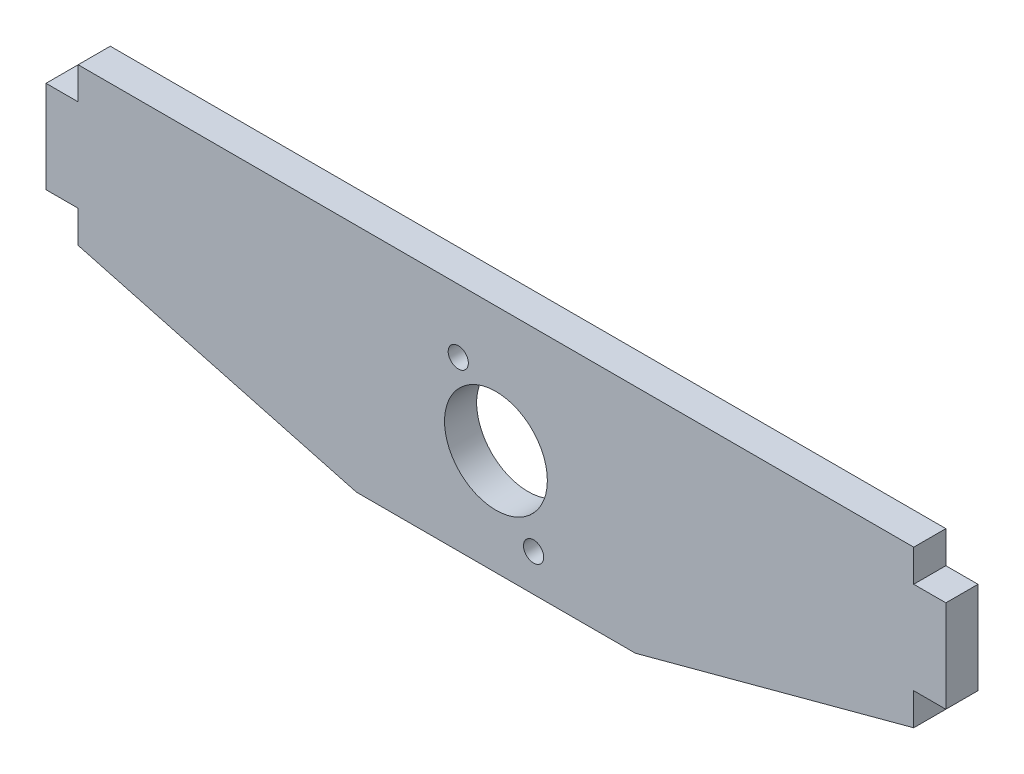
SolidWorks part; units mm, degrees
ref_plane "Front Plane" through (0, 0, 0) normal (0, 0, 1) x (1, 0, 0)
ref_plane "Top Plane" through (0, 0, 0) normal (0, 1, 0) x (1, 0, 0)
ref_plane "Right Plane" through (0, 0, 0) normal (1, 0, 0) x (0, 0, -1)
sketch "Sketch1" plane through (0, 0, 0) normal (0, 0, 1) x (1, 0, 0)
  line L1 (-44.45, 12.7) -> (44.45, 12.7)
  line L2 (-44.45, 12.7) -> (-44.45, -12.7)
  line L3 (-44.45, -12.7) -> (44.45, -12.7)
  line L4 (44.45, 12.7) -> (44.45, -12.7)
  line L5 (-44.45, 12.7) -> (44.45, -12.7) construction
  line L6 (-44.45, -12.7) -> (44.45, 12.7) construction
  point P0 (0, 0)
  dimension "D1" = 25.4
  dimension "D2" = 88.9
extrude "Boss-Extrude1" add sketch "Sketch1" along normal mid plane 3.175
sketch "Sketch2" plane through (0, 0, 1.5875) normal (0, 0, 1) x (1, 0, 0)
  line L0 (0, 21.37) -> (0, -23.2469) construction
  line L1 (-44.45, 12.7) -> (-41.275, 12.7)
  line L2 (-44.45, 12.7) -> (-44.45, 9.525)
  line L3 (-44.45, 9.525) -> (-41.275, 9.525)
  line L4 (-41.275, 12.7) -> (-41.275, 9.525)
  line L5 (-48.7544, 0) -> (49.9487, 0) construction
  line L6 (41.275, 12.7) -> (41.275, 9.525)
  line L7 (44.45, 9.525) -> (41.275, 9.525)
  line L8 (44.45, 12.7) -> (44.45, 9.525)
  line L9 (44.45, 12.7) -> (41.275, 12.7)
  line L10 (44.45, -12.7) -> (41.275, -12.7)
  line L11 (44.45, -12.7) -> (44.45, -9.525)
  line L12 (44.45, -9.525) -> (41.275, -9.525)
  line L13 (41.275, -12.7) -> (41.275, -9.525)
  line L14 (-41.275, -12.7) -> (-41.275, -9.525)
  line L15 (-44.45, -9.525) -> (-41.275, -9.525)
  line L16 (-44.45, -12.7) -> (-44.45, -9.525)
  line L17 (-44.45, -12.7) -> (-41.275, -12.7)
  dimension "D1" = 3.175
  dimension "D2" = 3.175
extrude "Cut-Extrude1" cut sketch "Sketch2" against normal through all
sketch "Sketch3" plane through (0, 0, 1.5875) normal (0, 0, 1) x (1, 0, 0)
  line L0 (-44.45, 9.525) -> (-44.45, -9.525) construction
  line L2 (41.275, 12.7) -> (-41.275, 12.7) construction
  circle A0 centre (0, 0.3048) radius 5.08
  dimension "D1" = 10.16
  dimension "D2" = 44.45
  dimension "D3" = 12.3952
extrude "Cut-Extrude2" cut sketch "Sketch3" against normal through all
hole_wizard "#47 (0.0785) Diameter Hole1" positions "Sketch6" profile "Sketch7" hole size "#47" standard "Ansi Inch"
sketch "Sketch6" plane through (0, 0, 1.5875) normal (0, 0, 1) x (1, 0, 0)
  line L0 (0, 4.7347) -> (0, -4.7347) construction
  line L2 (0, 0) -> (-4.689, 8.1216) construction
  line L4 (0, 0) -> (4.1771, -7.235) construction
  point P0 (-3.7211, 6.4451)
  point P1 (3.7211, -6.4451)
  dimension "D1" = 30
  dimension "D2" = 14.8844
  dimension "D3" = 7.4422
sketch "Sketch7" plane through (-3.7211, 6.4451, 1.5875) normal (1, 0, 0) x (0, -1, 0)
  line L0 (0, 0) -> (0, 3.175)
  line L1 (0, 3.175) -> (0.9969, 3.175)
  line L2 (0.9969, 3.175) -> (0.9969, 0)
  line L5 (0.9969, 0) -> (0, 0)
  line L11 (0, -6.35) -> (0, 107.95) construction
  dimension "Thru Hole Dia." = 1.9939
  dimension "Thru Hole Depth" = 3.175
sketch "Sketch8" plane through (0, 0, 1.5875) normal (0, 0, 1) x (1, 0, 0)
  line L0 (-44.45, -1.905) -> (-13.7819, -10.1225)
  line L1 (-44.45, 9.525) -> (-44.45, -9.525) construction
  line L2 (44.45, -1.905) -> (13.7819, -10.1225)
  line L3 (44.45, -9.525) -> (44.45, 9.525) construction
  line L4 (-44.45, -1.905) -> (-44.45, -9.525)
  line L5 (-44.45, -9.525) -> (-41.275, -9.525)
  line L6 (-41.275, -9.525) -> (-41.275, -12.7)
  line L7 (-41.275, -12.7) -> (41.275, -12.7)
  line L8 (41.275, -12.7) -> (41.275, -9.525)
  line L9 (41.275, -9.525) -> (44.45, -9.525)
  line L10 (44.45, -9.525) -> (44.45, -1.905)
  line L11 (-13.7819, -10.1225) -> (13.7819, -10.1225)
  dimension "D1" = 7.62
  dimension "D2" = 7.62
  dimension "D3" = 31.75
  dimension "D4" = 75
extrude "Cut-Extrude4" cut sketch "Sketch8" against normal through all
sketch "Sketch10" plane through (0, 0, 1.5875) normal (0, 0, 1) x (1, 0, 0)
  line L0 (-44.45, -1.905) -> (-41.275, -2.7557)
  line L1 (-13.7819, -10.1225) -> (-44.45, -1.905) construction
  line L2 (-41.275, -2.7557) -> (-41.275, 0.4193)
  line L3 (-41.275, 0.4193) -> (-44.45, 0.4193)
  line L4 (-44.45, 9.525) -> (-44.45, -1.905) construction
  line L5 (-44.45, 0.4193) -> (-44.45, -1.905)
  line L6 (0, 19.6151) -> (0, -16.3444) construction
  line L7 (44.45, 0.4193) -> (44.45, -1.905)
  line L8 (41.275, 0.4193) -> (44.45, 0.4193)
  line L9 (41.275, -2.7557) -> (41.275, 0.4193)
  line L10 (44.45, -1.905) -> (41.275, -2.7557)
  dimension "D1" = 3.175
  dimension "D2" = 3.175
extrude "Cut-Extrude6" cut sketch "Sketch10" against normal through all
